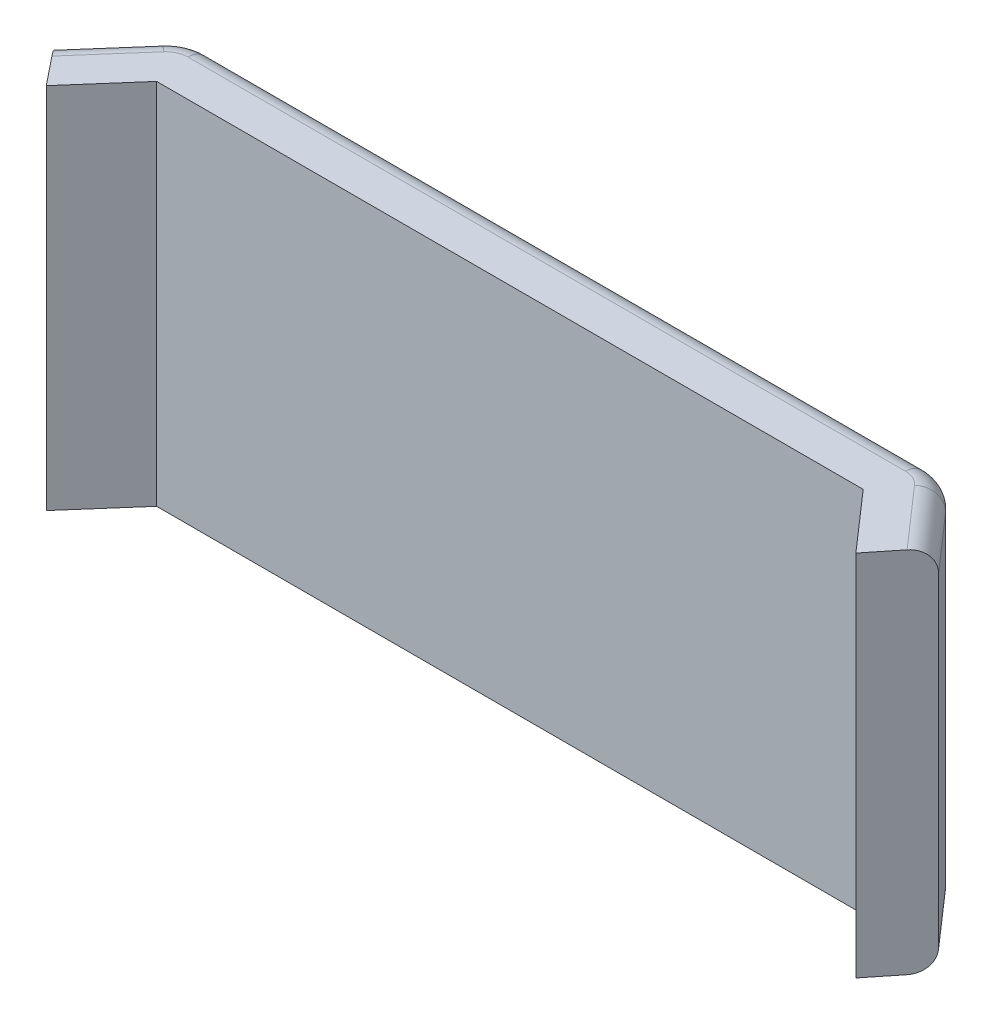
SolidWorks part; units mm, degrees
other "Solid1"
ref_plane "Front Plane" through (0, 0, 0) normal (0, 0, 1) x (1, 0, 0)
ref_plane "Top Plane" through (0, 0, 0) normal (0, 1, 0) x (1, 0, 0)
ref_plane "Right Plane" through (0, 0, 0) normal (1, 0, 0) x (0, 0, -1)
imported_body "Imported1"
sketch "Sketch1" plane through (0, 0, -4) normal (0, 0, -1) x (-1, 0, 0)
  line L0 (-24.3709, -1.25) -> (24.3709, -1.25) construction
  line L1 (-24.3709, 11) -> (-24.3709, -11) construction
  line L2 (24.3709, -11) -> (24.3709, 11) construction
  line L3 (-24.3709, -12.5) -> (24.3709, -12.5) construction
  text T0 "GreenLab" font "Copperplate Gothic Bold" height 2.5
  dimension "D1" = 11.25
extrude "Cut-Extrude1" cut sketch "Sketch1" against normal blind 0.5
